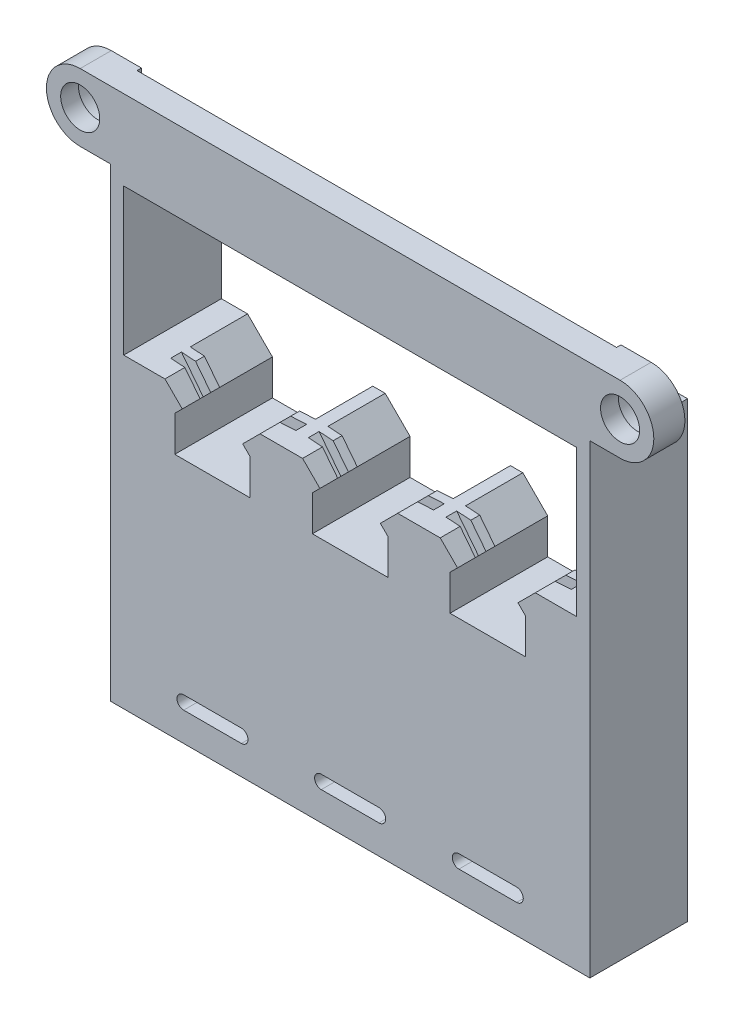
SolidWorks part; units mm, degrees
ref_plane "Front Plane" through (0, 0, 0) normal (0, 0, 1) x (1, 0, 0)
ref_plane "Top Plane" through (0, 0, 0) normal (0, 1, 0) x (1, 0, 0)
ref_plane "Right Plane" through (0, 0, 0) normal (1, 0, 0) x (0, 0, -1)
sketch "Sketch1" plane through (0, 0, 0) normal (0, 0, 1) x (1, 0, 0)
  line L1 (0, 0) -> (54, 0)
  line L2 (0, 0) -> (0, 60)
  line L3 (0, 60) -> (54, 60)
  line L4 (54, 0) -> (54, 60)
  dimension "D1" = 54
  dimension "D2" = 60
extrude "Boss-Extrude1" add sketch "Sketch1" along normal blind 11
sketch "Sketch2" plane through (0, 0, 11) normal (0, 0, 1) x (1, 0, 0)
  line L0 (1.5, 51) -> (52.5, 51)
  line L1 (1.5, 51) -> (1.5, 34.5)
  line L2 (1.5, 34.5) -> (4.4485, 34.5)
  line L3 (4.4485, 34.5) -> (7.25, 31.6985)
  line L4 (7.25, 31.6985) -> (7.25, 27.6985)
  line L5 (7.25, 27.6985) -> (15.75, 27.6985)
  line L6 (15.75, 27.6985) -> (15.75, 31.6985)
  line L7 (15.75, 31.6985) -> (18.5515, 34.5)
  line L8 (18.5515, 34.5) -> (19.9485, 34.5)
  line L9 (19.9485, 34.5) -> (22.75, 31.6985)
  line L10 (22.75, 31.6985) -> (22.75, 27.6985)
  line L11 (22.75, 27.6985) -> (31.25, 27.6985)
  line L12 (31.25, 27.6985) -> (31.25, 31.6985)
  line L13 (31.25, 31.6985) -> (34.0515, 34.5)
  line L14 (34.0515, 34.5) -> (35.4485, 34.5)
  line L15 (35.4485, 34.5) -> (38.25, 31.6985)
  line L16 (38.25, 31.6985) -> (38.25, 27.6985)
  line L17 (38.25, 27.6985) -> (46.75, 27.6985)
  line L18 (46.75, 27.6985) -> (46.75, 31.6985)
  line L19 (46.75, 31.6985) -> (49.5515, 34.5)
  line L20 (49.5515, 34.5) -> (52.5, 34.5)
  line L21 (52.5, 34.5) -> (52.5, 51)
  line L22 (0, 60) -> (0, 0) construction
  line L23 (54, 0) -> (54, 60) construction
  line L24 (54, 60) -> (0, 60) construction
  line L25 (8.25, 4) -> (14.75, 4) construction
  line L26 (8.25, 4.75) -> (14.75, 4.75)
  line L27 (8.25, 3.25) -> (14.75, 3.25)
  line L28 (0, 0) -> (54, 0) construction
  line L29 (23.75, 4) -> (30.25, 4) construction
  line L30 (23.75, 4.75) -> (30.25, 4.75)
  line L31 (23.75, 3.25) -> (30.25, 3.25)
  line L32 (39.25, 4) -> (45.75, 4) construction
  line L33 (39.25, 4.75) -> (45.75, 4.75)
  line L34 (39.25, 3.25) -> (45.75, 3.25)
  arc A0 (8.25, 4.75) -> (8.25, 3.25) centre (8.25, 4) ccw
  arc A1 (14.75, 3.25) -> (14.75, 4.75) centre (14.75, 4) ccw
  arc A2 (23.75, 4.75) -> (23.75, 3.25) centre (23.75, 4) ccw
  arc A3 (30.25, 3.25) -> (30.25, 4.75) centre (30.25, 4) ccw
  arc A4 (39.25, 4.75) -> (39.25, 3.25) centre (39.25, 4) ccw
  arc A5 (45.75, 3.25) -> (45.75, 4.75) centre (45.75, 4) ccw
  point P34 (11.5, 4)
  point P39 (7.5, 4)
  point P40 (15.5, 4)
  point P44 (11.5, 27.6985)
  point P47 (27, 4)
  point P54 (42.5, 4)
  point P59 (27, 27.6985)
  point P61 (42.5, 27.6985)
  dimension "D1" = 1.5
  dimension "D2" = 1.5
  dimension "D3" = 9
  dimension "D4" = 8.5
  dimension "D5" = 45
  dimension "D6" = 45
  dimension "D7" = 8
  dimension "D8" = 1.5
  dimension "D9" = 4
  dimension "D11" = 4
  dimension "D12" = 16.5
  dimension "D10" = 3
extrude "Cut-Extrude1" cut sketch "Sketch2" against normal through all
sketch "Sketch3" plane through (19.4742, 19.4742, 0) normal (0.7071, 0.7071, 0) x (0, 0, -1)
  line L1 (0, 21.2496) -> (-11, 21.2496) construction
  line L2 (-8.6534, 21.2496) -> (-9, 17.2877)
  line L3 (0, 17.2877) -> (-11, 17.2877) construction
  line L6 (-7.4488, 21.2496) -> (-7.7954, 17.2877)
  line L7 (-7.7954, 17.2877) -> (-6.7954, 17.2877)
  line L8 (-6.7954, 17.2877) -> (-6.4488, 21.2496)
  line L9 (-6.4488, 21.2496) -> (-7.4488, 21.2496)
  line L10 (-8.6534, 21.2496) -> (-11, 21.2496)
  line L11 (-11, 21.2496) -> (-11, 17.2877)
  line L12 (-11, 17.2877) -> (-9, 17.2877)
  dimension "D3" = 2
  dimension "D4" = 1.2
extrude "Boss-Extrude2" add sketch "Sketch3" along normal blind 1.2 contours L2 L12 L11 L10 | L8 L9 L6 L7
sketch "Sketch5" plane through (0, 0, 0) normal (0, 0, 1) x (1, 0, 0)
  line L0 (11.5, 27.6985) -> (11.5, 34.7521)
  line L1 (7.25, 27.6985) -> (15.75, 27.6985) construction
ref_plane "Plane1" through (11.5, 0, 0) normal (1, 0, 0) x (0, 1, 0)
mirror "Mirror1" about plane through (11.5, 0, 0) normal (1, 0, 0) of "Boss-Extrude2"
pattern_linear "LPattern2" count 3 spacing 15.5 along (1, 0, 0) of "Mirror1", "Boss-Extrude2"
sketch "Sketch7" plane through (0, 0, 0) normal (0, 0, 1) x (1, 0, 0)
  line L0 (1.5, 34.5) -> (4.4485, 34.5) construction
  line L1 (4.4485, 34.5) -> (49.5515, 34.5)
  line L2 (4.4485, 34.5) -> (4.4485, 36.5715)
  line L3 (4.4485, 36.5715) -> (49.5515, 36.5715)
  line L4 (49.5515, 34.5) -> (49.5515, 36.5715)
  line L5 (49.5515, 34.5) -> (52.5, 34.5) construction
extrude "Cut-Extrude3" cut sketch "Sketch7" along normal through all contours L1 L4 L3 L2
sketch "Sketch12" plane through (0, 0, 11) normal (0, 0, 1) x (1, 0, 0)
  line L0 (54, 56.2) -> (57.4, 56.2) construction
  line L1 (54, 60) -> (57.4, 60)
  line L2 (54, 52.4) -> (57.4, 52.4)
  line L4 (0, 56.2) -> (-3.4, 56.2) construction
  line L5 (0, 52.4) -> (-3.4, 52.4)
  line L6 (0, 60) -> (-3.4, 60)
  arc A0 (54, 60) -> (54, 52.4) centre (54, 56.2) ccw
  arc A1 (57.4, 52.4) -> (57.4, 60) centre (57.4, 56.2) ccw
  arc A2 (0, 52.4) -> (0, 60) centre (0, 56.2) ccw
  arc A3 (-3.4, 60) -> (-3.4, 52.4) centre (-3.4, 56.2) ccw
  point P2 (55.7, 56.2)
  point P7 (-1.7, 56.2)
  point P8 (0, 0)
  point P17 (0, 0)
  point P18 (0, 0)
  dimension "D2" = 3.8
  dimension "D4" = 3.8
  dimension "D1" = 3.4
  dimension "D5" = 3.4
extrude "Boss-Extrude3" add sketch "Sketch12" against normal blind 3.5 contours A3 L5 A2 L6 | A1 L1 A0 L2
sketch "Sketch9" plane through (0, 0, 0) normal (0, 0, -1) x (-1, 0, 0)
  line L0 (0, 60) -> (0, 0) construction
  line L1 (-54, 60) -> (0, 60)
  line L2 (-54, 60) -> (-54, 51)
  line L3 (-54, 51) -> (0, 51)
  line L4 (0, 60) -> (0, 51)
  line L5 (-52.5, 51) -> (-1.5, 51) construction
extrude "Cut-Extrude5" cut sketch "Sketch9" against normal blind 8
sketch "Sketch14" plane through (0, 0, 7.5) normal (0, 0, -1) x (-1, 0, 0)
  circle A0 centre (-57.4, 56.2) radius 2.2
  arc A1 (-57.4, 60) -> (-57.4, 52.4) centre (-57.4, 56.2) ccw construction
  circle A2 centre (3.4, 56.2) radius 2.2
  arc A3 (3.4, 52.4) -> (3.4, 60) centre (3.4, 56.2) ccw construction
  dimension "D1" = 4.4
  dimension "D2" = 4.4
extrude "Cut-Extrude6" cut sketch "Sketch14" against normal through all
sketch "Sketch15" plane through (0, 0, 7.5) normal (0, 0, -1) x (-1, 0, 0)
  circle A0 centre (-57.4, 56.2) radius 2.6
  circle A1 centre (3.4, 56.2) radius 2.6
  dimension "D1" = 5.2
  dimension "D2" = 5.2
extrude "Cut-Extrude7" cut sketch "Sketch15" against normal blind 1.5
